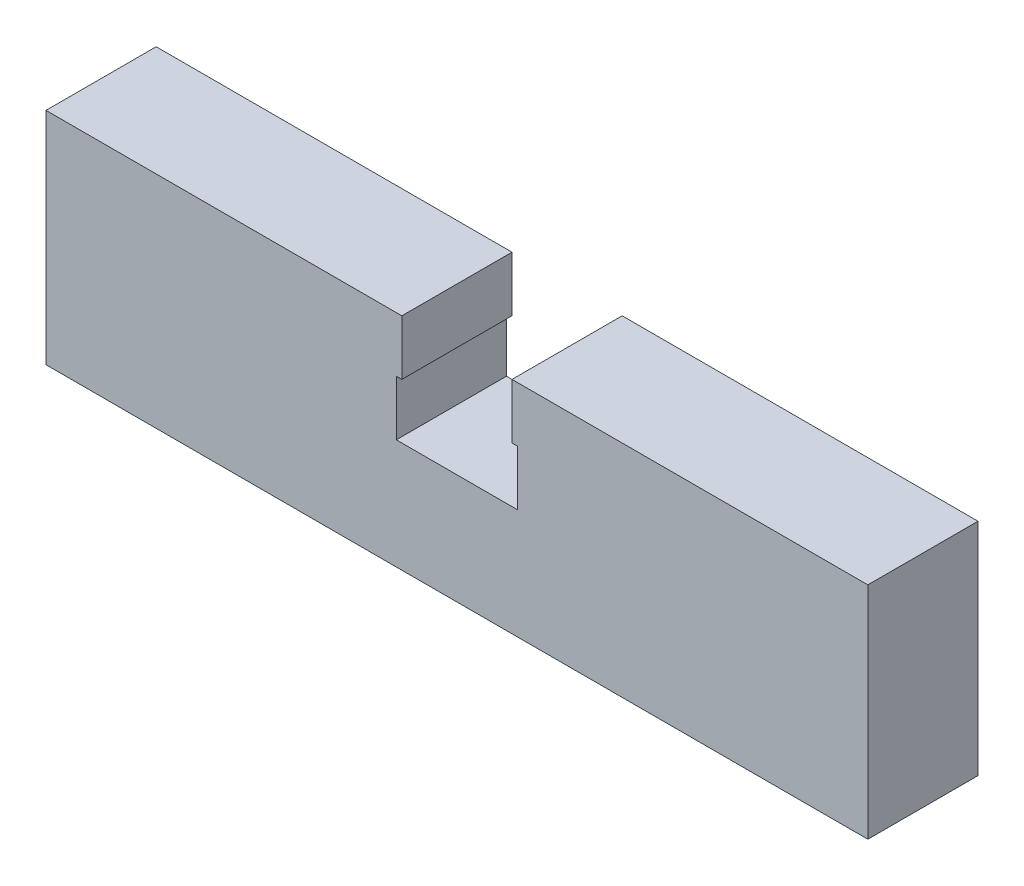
SolidWorks part; units mm, degrees
ref_plane "Alzado" through (0, 0, 0) normal (0, 0, 1) x (1, 0, 0)
ref_plane "Planta" through (0, 0, 0) normal (0, 1, 0) x (1, 0, 0)
ref_plane "Vista lateral" through (0, 0, 0) normal (1, 0, 0) x (0, 0, -1)
sketch "Croquis1" plane through (0, 0, 0) normal (0, 0, 1) x (1, 0, 0)
  line L0 (6.35, 12.7) -> (47.371, 12.7)
  line L1 (-47.371, -12.7) -> (47.371, -12.7)
  line L2 (-47.371, -12.7) -> (-47.371, 12.7)
  line L3 (-47.371, 12.7) -> (-6.35, 12.7)
  line L4 (47.371, -12.7) -> (47.371, 12.7)
  line L5 (-47.371, -12.7) -> (47.371, 12.7) construction
  line L6 (-47.371, 12.7) -> (47.371, -12.7) construction
  line L8 (-6.35, 12.7) -> (-6.35, 0)
  line L9 (-6.35, 0) -> (6.35, 0)
  line L10 (6.35, 12.7) -> (6.35, 0)
  point P0 (0, 0)
  point P10 (20.4177, 1.8244)
  dimension "D1" = 94.742
  dimension "D2" = 25.4
  dimension "D3" = 12.7
  dimension "D4" = 12.7
  dimension "D5" = 6.35
extrude "Saliente-Extruir1" add sketch "Croquis1" along normal blind 12.7
sketch "Croquis5" plane through (0, 0, 12.7) normal (0, 0, 1) x (1, 0, 0)
  line L0 (-6.35, 0) -> (-6.35, 12.7) construction
  line L1 (-6.35, 6.35) -> (-6.985, 6.35)
  line L2 (-6.35, 6.35) -> (-6.35, 0)
  line L3 (-6.35, 0) -> (-6.985, 0)
  line L4 (-6.985, 6.35) -> (-6.985, 0)
  line L6 (6.35, 0) -> (6.985, 0)
  line L7 (6.35, 0) -> (6.35, 6.35)
  line L8 (6.35, 6.35) -> (6.985, 6.35)
  line L9 (6.985, 0) -> (6.985, 6.35)
  dimension "D1" = 0.635
  dimension "D2" = 6.35
  dimension "D3" = 0.635
  dimension "D4" = 6.35
extrude "Cortar-Extruir2" cut sketch "Croquis5" against normal through all
